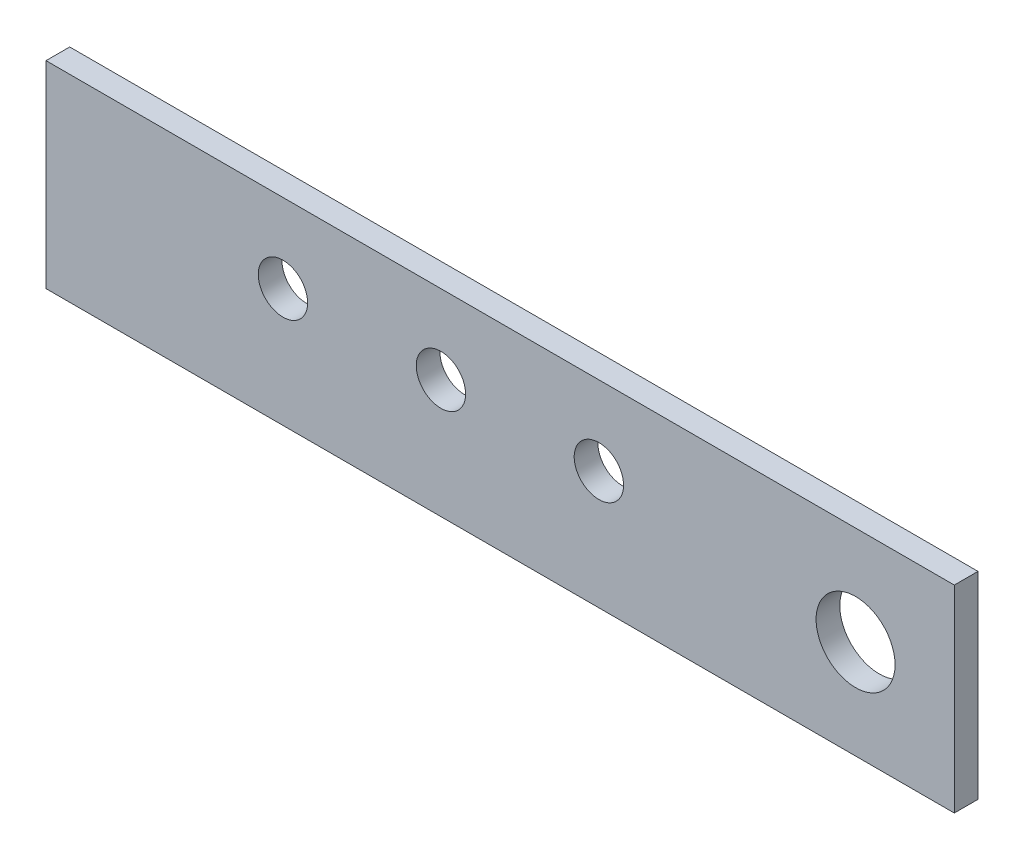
SolidWorks part; units mm, degrees
ref_plane "Plan de face" through (0, 0, 0) normal (0, 0, 1) x (1, 0, 0)
ref_plane "Plan de dessus" through (0, 0, 0) normal (0, 1, 0) x (1, 0, 0)
ref_plane "Plan de droite" through (0, 0, 0) normal (1, 0, 0) x (0, 0, -1)
sketch "Esquisse1" plane through (0, 0, 0) normal (0, 0, 1) x (1, 0, 0)
  line L0 (0, -50) -> (400.4532, -50) construction
  line L1 (0, 0) -> (460, 0)
  line L2 (0, 0) -> (0, -100)
  line L3 (0, -100) -> (460, -100)
  line L4 (460, 0) -> (460, -100)
  circle A0 centre (410, -50) radius 20
  circle A2 centre (120, -40) radius 12.5
  circle A3 centre (200, -40) radius 12.5
  circle A4 centre (280, -40) radius 12.5
  dimension "D4" = 120
  dimension "D3" = 410
  dimension "D2" = 40
  dimension "D6" = 80
  dimension "D7" = 25
  dimension "D8" = 25
  dimension "D9" = 25
  dimension "D10" = 40
  dimension "D1" = 100
  dimension "D5" = 80
  dimension "D11" = 460
  dimension "D12" = 460
extrude "Extrusion1" add sketch "Esquisse1" along normal blind 12
